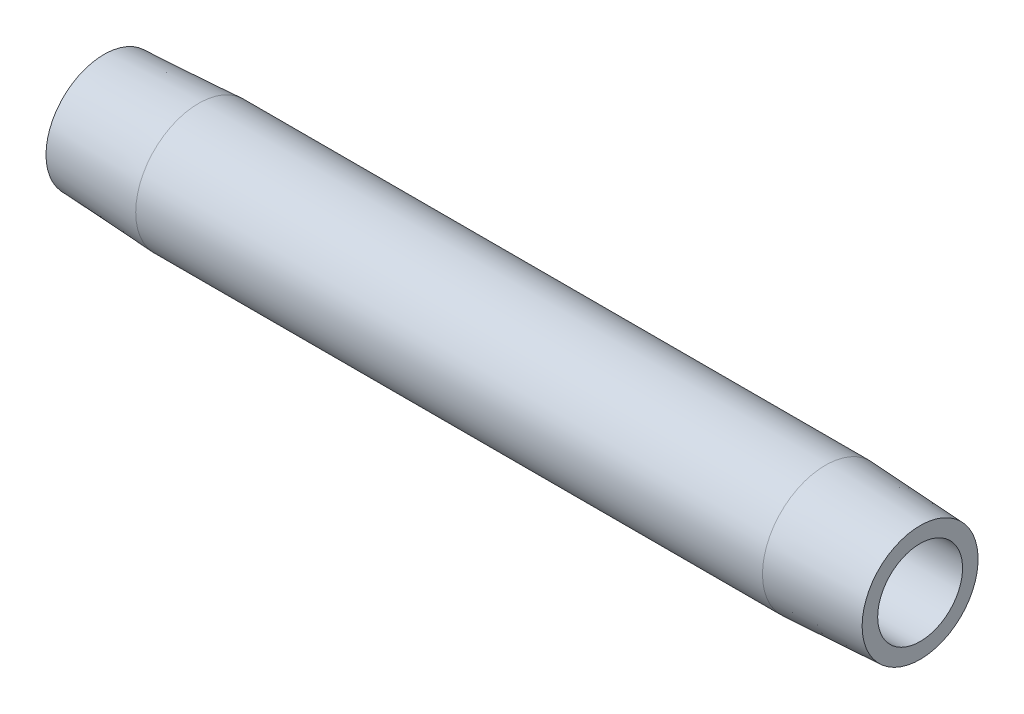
SolidWorks part; units mm, degrees
ref_plane "Front Plane" through (0, 0, 0) normal (0, 0, 1) x (1, 0, 0)
ref_plane "Top Plane" through (0, 0, 0) normal (0, 1, 0) x (1, 0, 0)
ref_plane "Right Plane" through (0, 0, 0) normal (1, 0, 0) x (0, 0, -1)
sketch "Sketch1" plane through (0, 0, 0) normal (0, 1, 0) x (1, 0, 0)
  line L6 (88.9, 4.6228) -> (0, 4.6228)
  line L7 (10.3124, 6.858) -> (0, 6.3175)
  line L8 (0, 6.3175) -> (0, 4.6228)
  line L9 (78.5876, 6.858) -> (10.3124, 6.858)
  line L10 (88.9, 6.3175) -> (78.5876, 6.858)
  line L11 (88.9, 4.6228) -> (88.9, 6.3175)
  line L12 (-6.376, 0) -> (49993.624, 0) construction
  dimension "D1" = 9.2456
  dimension "D2" = 13.716
  dimension "D3" = 3
  dimension "D4" = 3
  dimension "D5" = 88.9
  dimension "D6" = 10.3124
  dimension "D7" = 10.3124
revolve "Revolve1" add sketch "Sketch1" angle 360 about L12
